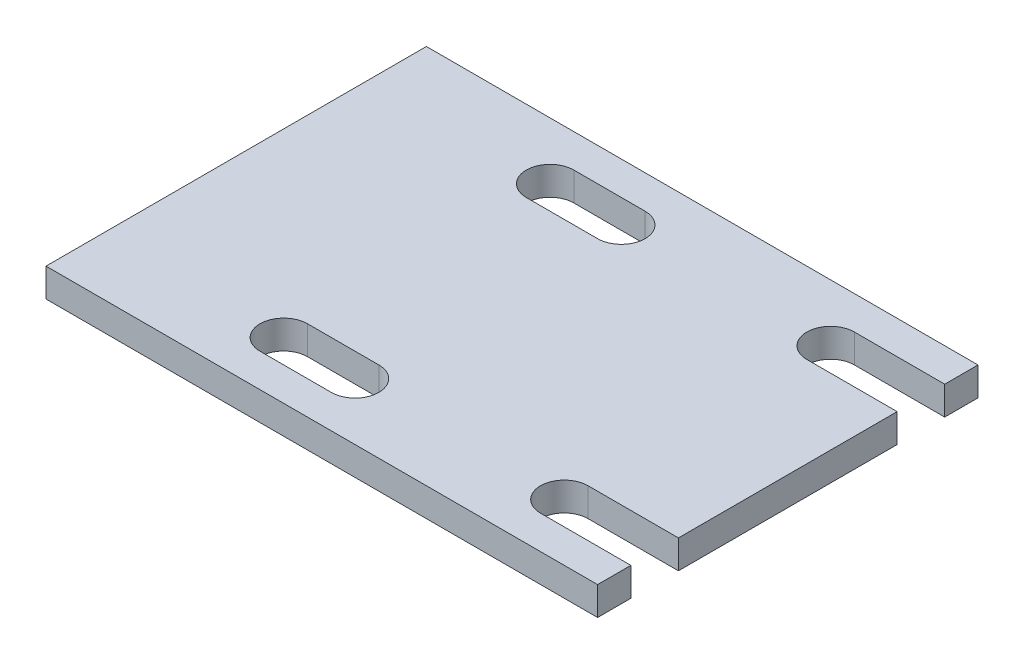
SolidWorks part; units mm, degrees
ref_plane "Front" through (0, 0, 0) normal (0, 0, 1) x (1, 0, 0)
ref_plane "Top" through (0, 0, 0) normal (0, 1, 0) x (1, 0, 0)
ref_plane "Right" through (0, 0, 0) normal (1, 0, 0) x (0, 0, -1)
sketch "Sketch1" plane through (0, 0, 0) normal (0, 1, 0) x (1, 0, 0)
  line L1 (0, 0) -> (368.3, 0)
  line L2 (0, 0) -> (0, 254)
  line L3 (0, 254) -> (368.3, 254)
  line L4 (368.3, 0) -> (368.3, 254)
  dimension "D1" = 368.3
  dimension "D2" = 254
extrude "Boss-Extrude1" add sketch "Sketch1" along normal blind 19.05
sketch "Sketch3" plane through (0, 19.05, 0) normal (0, 1, 0) x (1, 0, 0)
  line L0 (0, 254) -> (0, 0) construction
  line L1 (0, 0) -> (368.3, 0) construction
  line L2 (120.65, 53.975) -> (168.275, 53.975)
  line L3 (168.275, 22.225) -> (120.65, 22.225)
  line L4 (0, 127) -> (368.3, 127) construction
  line L5 (368.3, 0) -> (368.3, 254) construction
  line L6 (168.275, 231.775) -> (120.65, 231.775)
  line L7 (120.65, 200.025) -> (168.275, 200.025)
  arc A0 (120.65, 53.975) -> (120.65, 22.225) centre (120.65, 38.1) ccw
  arc A1 (168.275, 22.225) -> (168.275, 53.975) centre (168.275, 38.1) ccw
  arc A2 (120.65, 200.025) -> (120.65, 231.775) centre (120.65, 215.9) cw
  arc A3 (168.275, 231.775) -> (168.275, 200.025) centre (168.275, 215.9) cw
  dimension "D1" = 31.75
  dimension "D2" = 47.625
  dimension "D3" = 120.65
  dimension "D4" = 38.1
extrude "Cut-Extrude2" cut sketch "Sketch3" against normal through all
sketch "Sketch4" plane through (0, 19.05, 0) normal (0, 1, 0) x (1, 0, 0)
  line L0 (0, 0) -> (368.3, 0) construction
  line L1 (368.3, 0) -> (368.3, 254) construction
  line L2 (307.975, 53.975) -> (368.3, 53.975)
  line L3 (307.975, 22.225) -> (368.3, 22.225)
  line L4 (368.3, 22.225) -> (368.3, 53.975)
  line L5 (0, 127) -> (368.3, 127) construction
  line L6 (0, 254) -> (0, 0) construction
  line L7 (307.975, 231.775) -> (368.3, 231.775)
  line L8 (368.3, 231.775) -> (368.3, 200.025)
  line L9 (307.975, 200.025) -> (368.3, 200.025)
  arc A0 (307.975, 53.975) -> (307.975, 22.225) centre (307.975, 38.1) ccw
  arc A2 (307.975, 200.025) -> (307.975, 231.775) centre (307.975, 215.9) cw
  dimension "D1" = 31.75
  dimension "D2" = 38.1
  dimension "D3" = 60.325
extrude "Cut-Extrude3" cut sketch "Sketch4" against normal through all
